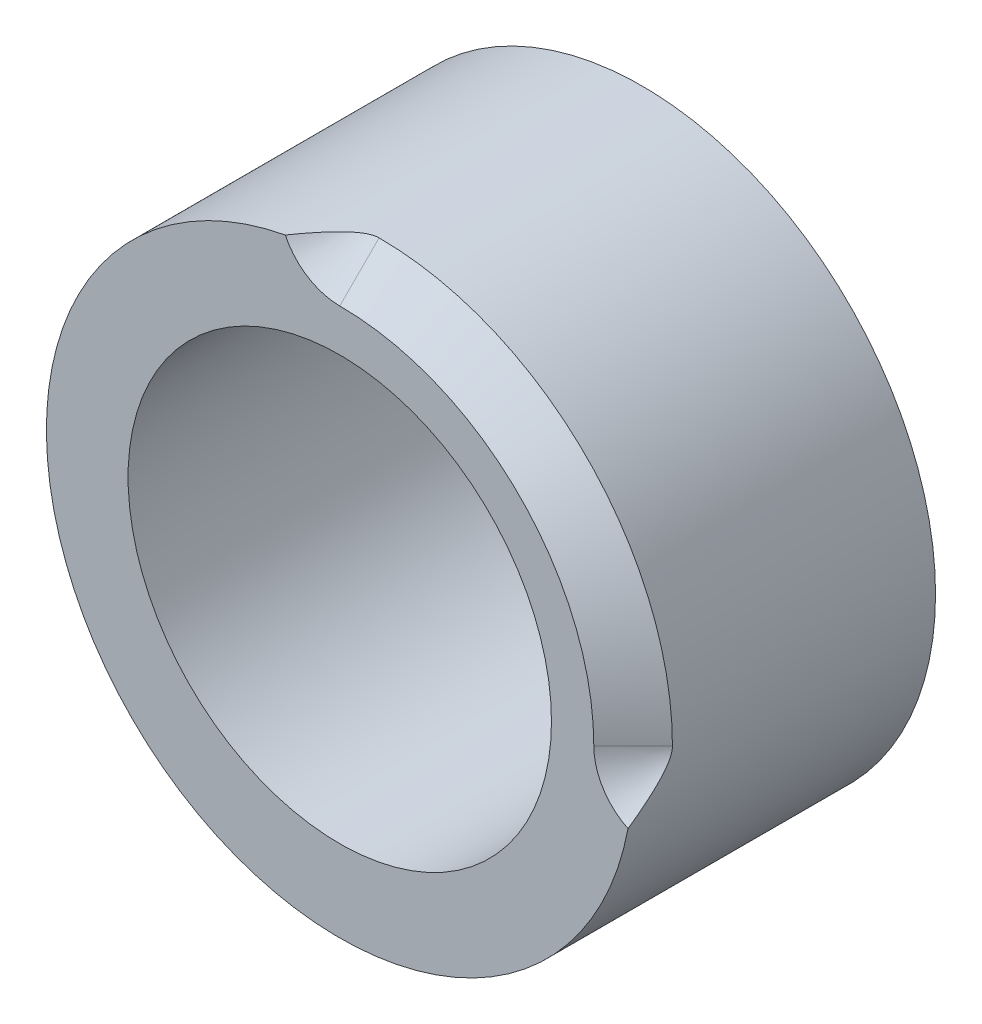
SolidWorks part; units mm, degrees
ref_plane "Ebene vorne" through (0, 0, 0) normal (0, 0, 1) x (1, 0, 0)
ref_plane "Ebene oben" through (0, 0, 0) normal (0, 1, 0) x (1, 0, 0)
ref_plane "Ebene rechts" through (0, 0, 0) normal (1, 0, 0) x (0, 0, -1)
sketch "Skizze1" plane through (0, 0, 0) normal (0, 0, 1) x (1, 0, 0)
  circle A0 centre (0, 0) radius 35
  circle A1 centre (0, 0) radius 48.5
  dimension "D1" = 97
  dimension "D2" = 70
extrude "Linear austragen1" add sketch "Skizze1" against normal blind 50
sketch "Skizze2" plane through (0, 0, 0) normal (0, 0, 1) x (1, 0, 0)
  line L0 (0, 48.5) -> (0, 0) construction
  line L1 (0, 0) -> (48.5, 0) construction
  line L2 (52, -10) -> (52, 0) construction
  line L3 (52, 0) -> (48.5, 0) construction
  circle A0 centre (0, 0) radius 48.5 construction
  arc A1 (42, 0) -> (0, 42) centre (0, 0) ccw
  arc A2 (0, 42) -> (-10, 52) centre (0, 52) cw
  arc A4 (42, 0) -> (52, -10) centre (52, 0) ccw
  dimension "D1" = 42
  dimension "D2" = 10
  dimension "D3" = 3.5
ref_plane "Ebene1" through (52, -10, 0) normal (1, 0, 0) x (0, 0, -1)
sketch "Skizze3" plane through (52, -10, 0) normal (1, 0, 0) x (0, 0, -1)
  line L0 (-31.1747, 10) -> (37.4005, 10) construction
  line L1 (-10, 10) -> (-10, -10)
  line L2 (-10, -10) -> (10, 10)
  line L3 (10, 10) -> (-10, 10)
  dimension "D1" = 20
sweep "Schnitt-Austragung1" cut profiles "Skizze3" path "Skizze2"
equation "\"LÄNGE\"=0"
equation "\"BREITE\"=0"
equation "\"HÖHE\"=0"
equation "\"DURCHMESSER\"=0"
equation "\"Stückzahl\"= 1"
